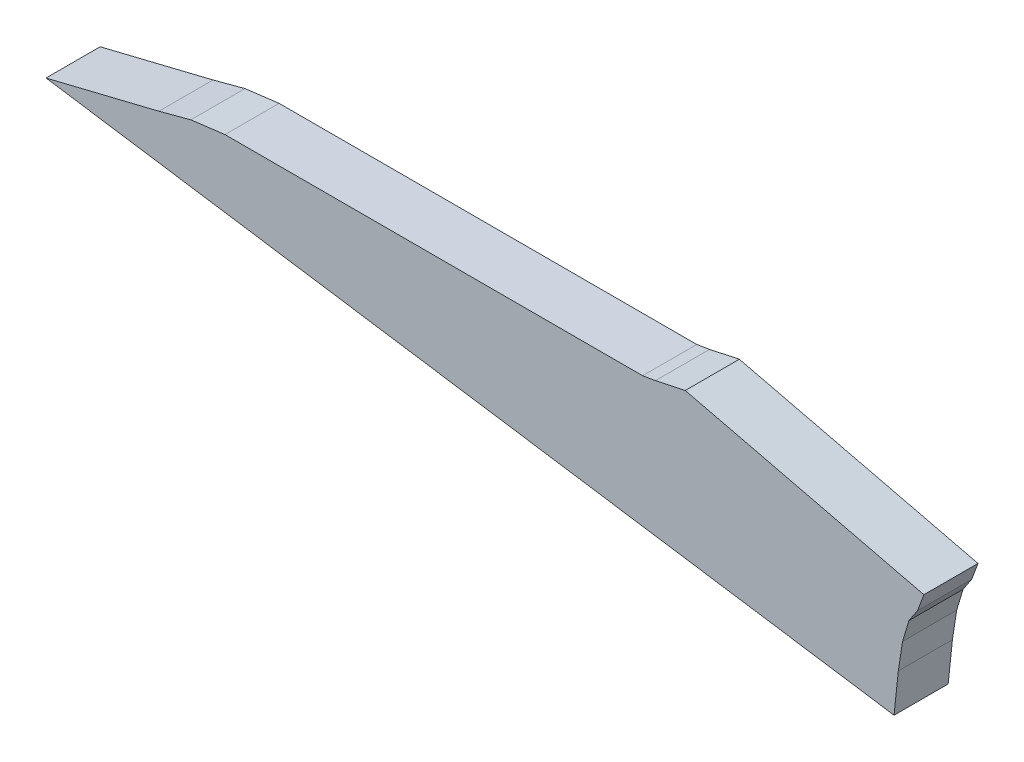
SolidWorks part; units mm, degrees
ref_plane "Front Plane" through (0, 0, 0) normal (0, 0, 1) x (1, 0, 0)
ref_plane "Top Plane" through (0, 0, 0) normal (0, 1, 0) x (1, 0, 0)
ref_plane "Right Plane" through (0, 0, 0) normal (1, 0, 0) x (0, 0, -1)
ref_plane "Plane1" through (0, 0, 8.4) normal (0, 0, 1) x (1, 0, 0)
sketch "Sketch1" plane through (0, 0, 8.4) normal (0, 0, 1) x (1, 0, 0)
  line L0 (276, 126) -> (674, 66)
  line L1 (674, 66) -> (676, 85)
  line L2 (676, 85) -> (678, 98)
  line L3 (678, 98) -> (681, 108)
  line L4 (681, 108) -> (685, 114)
  line L5 (685, 114) -> (688, 122)
  line L6 (688, 122) -> (576, 149)
  line L7 (576, 149) -> (562, 146)
  line L8 (562, 146) -> (556, 145)
  line L9 (556, 145) -> (360, 145)
  line L10 (360, 145) -> (344, 143)
  line L11 (344, 143) -> (329, 139)
  line L12 (329, 139) -> (276, 126)
extrude "Extrude1" add sketch "Sketch1" against normal blind 25.4
